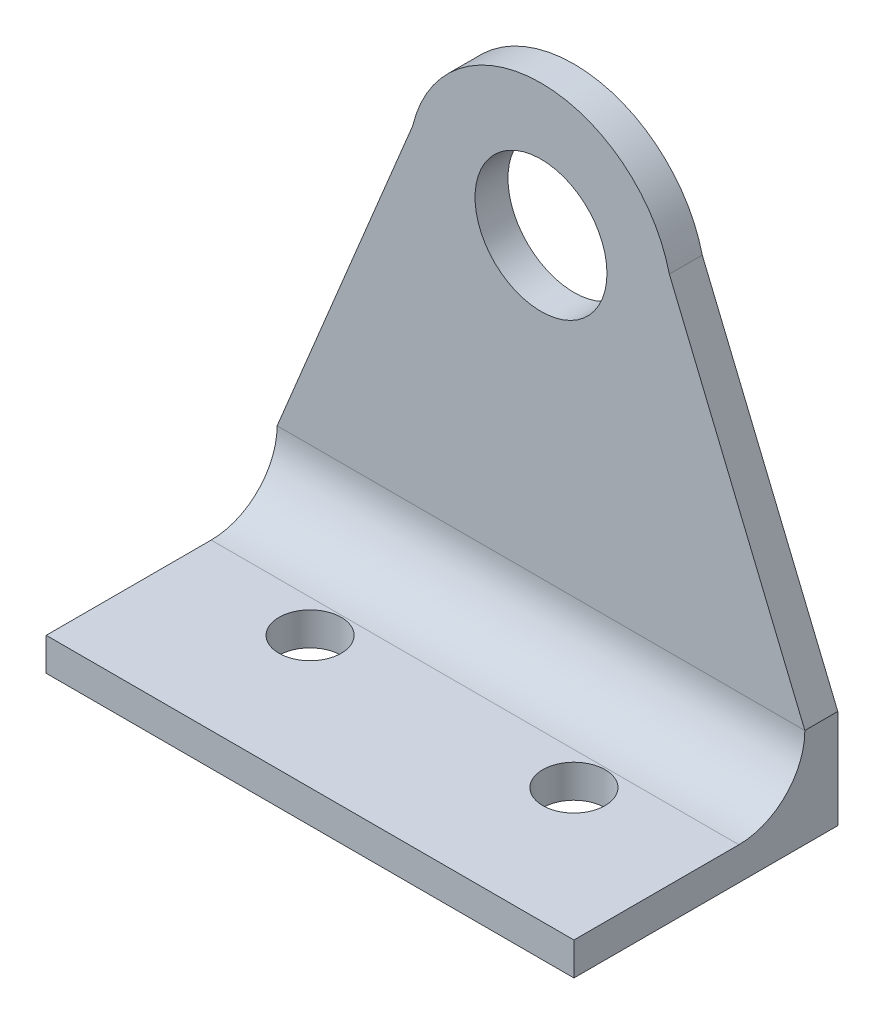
SolidWorks part; units mm, degrees
ref_plane "Front Plane" through (0, 0, 0) normal (0, 0, 1) x (1, 0, 0)
ref_plane "Top Plane" through (0, 0, 0) normal (0, 1, 0) x (1, 0, 0)
ref_plane "Right Plane" through (0, 0, 0) normal (1, 0, 0) x (0, 0, -1)
sketch "Sketch1" plane through (0, 0, 0) normal (1, 0, 0) x (0, 0, -1)
  line L0 (0, 0) -> (25.4, 0)
  line L1 (25.4, 0) -> (25.4, 50.8)
  line L2 (0, 3.17) -> (22.23, 3.17)
  line L3 (22.23, 3.17) -> (22.23, 50.8)
  line L4 (0, 3.17) -> (0, 0)
  line L5 (22.23, 50.8) -> (25.4, 50.8)
  dimension "D2" = 25.4
  dimension "D3" = 50.8
  dimension "D1" = 3.17
extrude "Boss-Extrude2" add sketch "Sketch1" along normal mid plane 50.8
fillet "Fillet2" radius 6.35 1 edges at (0, 3.17, -22.23)
hole_wizard "Ø6.0 (6) Diameter Hole2" positions "Sketch7" profile "Sketch6" hole size "Ø6.0" standard "ISO"
sketch "Sketch7" plane through (0, 3.17, 0) normal (0, 1, 0) x (-1, 0, 0)
  line L1 (-25.4, 0) -> (25.4, 0) construction
  line L2 (-25.4, -15.88) -> (-25.4, 0) construction
  point P0 (12.7, -12.7)
  point P1 (-12.7, -12.7)
  dimension "D1" = 38.1
  dimension "D2" = 12.7
  dimension "D3" = 12.7
  dimension "D4" = 12.7
sketch "Sketch6" plane through (-12.7, 3.17, -12.7) normal (1, 0, 0) x (0, 0, 1)
  line L0 (0, 0) -> (0, 3.17)
  line L1 (0, 3.17) -> (3, 3.17)
  line L2 (3, 3.17) -> (3, 0)
  line L5 (3, 0) -> (0, 0)
  line L11 (0, -6.35) -> (0, 107.95) construction
  dimension "Thru Hole Dia." = 6
  dimension "Thru Hole Depth" = 3.17
sketch "Sketch15" plane through (0, 0, -22.23) normal (0, 0, 1) x (1, 0, 0)
  line L0 (25.4, 50.8) -> (25.4, 9.52) construction
  line L1 (25.4, 0) -> (-25.4, 0) construction
  circle A0 centre (0, 38.1) radius 6.35
  dimension "D1" = 12.7
  dimension "D2" = 25.4
  dimension "D3" = 38.1
extrude "Cut-Extrude1" cut sketch "Sketch15" against normal through all
sketch "Sketch14" plane through (0, 0, -22.23) normal (0, 0, 1) x (1, 0, 0)
  line L0 (25.4, 50.8) -> (-25.4, 50.8) construction
  line L1 (-25.4, 9.52) -> (-10.8202, 44.7493)
  line L2 (25.4, 9.52) -> (10.8202, 44.7493)
  line L3 (25.4, 0) -> (-25.4, 0) construction
  line L4 (25.4, 0) -> (25.4, 50.8) construction
  circle A0 centre (0, 38.1) radius 12.7
  dimension "D2" = 25.4
  dimension "D3" = 38.1
  dimension "D4" = 25.4
extrude "Cut-Extrude2" cut sketch "Sketch14" against normal through all
